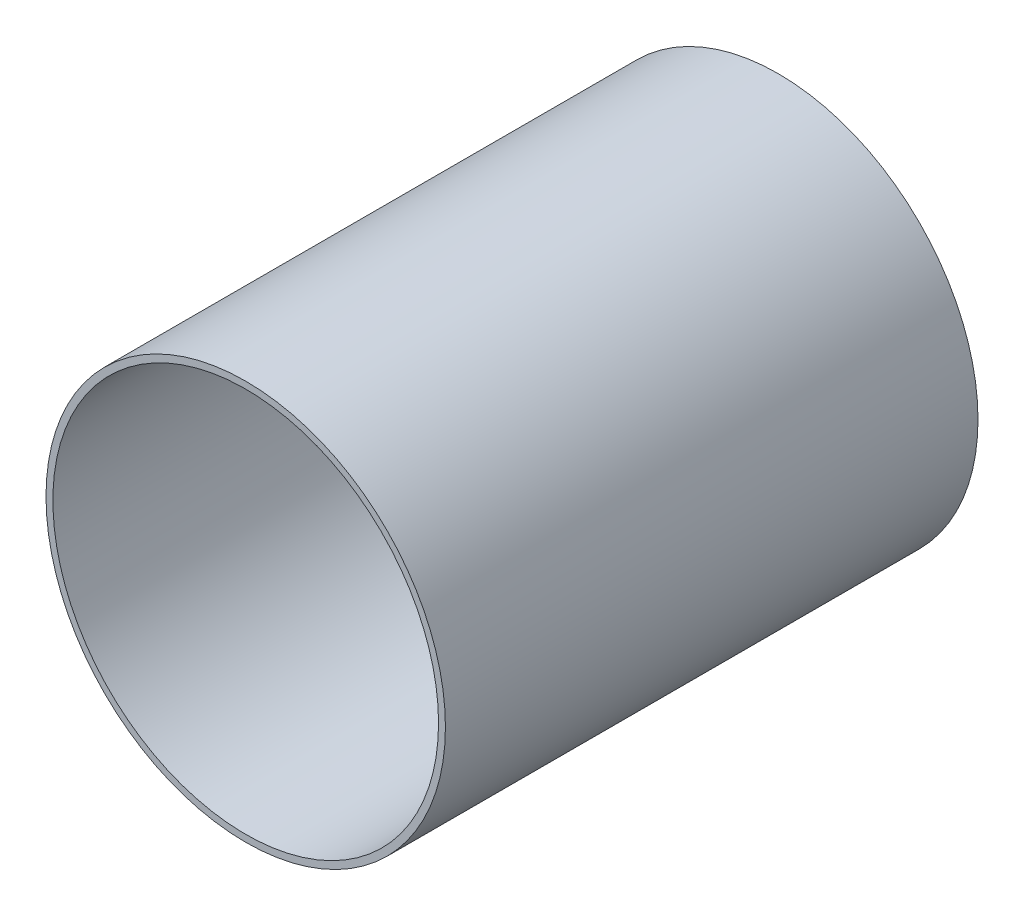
SolidWorks part; units mm, degrees
ref_plane "Front Plane" through (0, 0, 0) normal (0, 0, 1) x (1, 0, 0)
ref_plane "Top Plane" through (0, 0, 0) normal (0, 1, 0) x (1, 0, 0)
ref_plane "Right Plane" through (0, 0, 0) normal (1, 0, 0) x (0, 0, -1)
sketch "Sketch1" plane through (0, 0, 0) normal (0, 0, 1) x (1, 0, 0)
  circle A0 centre (0, 0) radius 76.2
  dimension "D1" = 152.4
extrude "Boss-Extrude1" add sketch "Sketch1" along normal blind 203.2
sketch "Sketch2" plane through (0, 0, 203.2) normal (0, 0, 1) x (1, 0, 0)
  circle A0 centre (0, 0) radius 73.5752
  dimension "D1" = 147.1504
extrude "Cut-Extrude1" cut sketch "Sketch2" against normal blind 304.8
